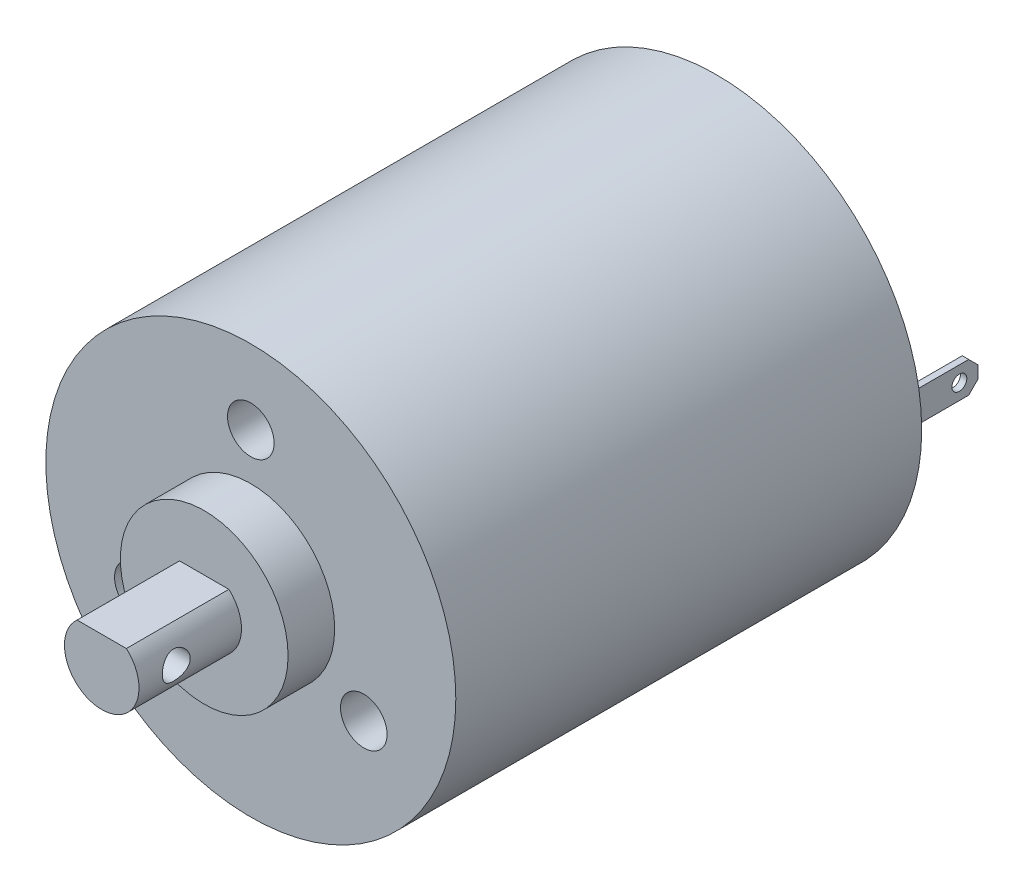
SolidWorks part; units mm, degrees
ref_plane "Plane1" through (0, 0, 0) normal (0, 0, 1) x (1, 0, 0)
ref_plane "Plane2" through (0, 0, 0) normal (0, 1, 0) x (1, 0, 0)
ref_plane "Plane3" through (0, 0, 0) normal (1, 0, 0) x (0, 0, -1)
sketch "Sketch1" plane through (0, 0, 0) normal (0, 0, 1) x (1, 0, 0)
  circle A0 centre (0, 0) radius 11
  dimension "D1" = 22
extrude "Base-Extrude" add sketch "Sketch1" against normal blind 25
sketch "Sketch2" plane through (0, 0, 0) normal (0, 0, 1) x (1, 0, 0)
  line L0 (-1.3229, 1.5) -> (1.3229, 1.5)
  arc A0 (-1.3229, 1.5) -> (1.3229, 1.5) centre (0, 0) ccw
  dimension "D1" = 4
  dimension "D2" = 1.5
extrude "Boss-Extrude1" add sketch "Sketch2" along normal blind 8
sketch "Sketch4" plane through (0, 0, 0) normal (0, 0, 1) x (1, 0, 0)
  circle A0 centre (0, 7) radius 1.25
  dimension "D1" = 2.5
  dimension "D2" = 7
extrude "Cut-Extrude2" cut sketch "Sketch4" against normal blind 4
pattern_circular "CirPattern1" count 3 over 360 about axis through (0, 0, 0) along (0, 0, 1) of "Cut-Extrude2"
sketch "Sketch5" plane through (0, 0, 0) normal (0, 0, 1) x (1, 0, 0)
  circle A0 centre (0, 0) radius 4.5
  dimension "D1" = 9
extrude "Boss-Extrude2" add sketch "Sketch5" along normal blind 2.5
sketch "Sketch6" plane through (0, 0, 0) normal (1, 0, 0) x (0, 0, -1)
  line L0 (25, 0) -> (0, 0) construction
  line L1 (-8, 1.5) -> (-8, -2) construction
  circle A0 centre (-6, 0) radius 0.75
  dimension "D1" = 1.5
  dimension "D2" = 2
extrude "Cut-Extrude3" cut sketch "Sketch6" against normal through all and the other way through all
sketch "Sketch7" plane through (0, 0, -25) normal (0, 0, -1) x (-1, 0, 0)
  line L0 (0, 0) -> (0, 4.1788) construction
  line L1 (-9.8202, 0.8326) -> (-9.4753, 0.8326)
  line L2 (-9.8202, 0.8326) -> (-9.8202, -0.8326)
  line L3 (-9.8202, -0.8326) -> (-9.4753, -0.8326)
  line L4 (-9.4753, 0.8326) -> (-9.4753, -0.8326)
  line L5 (0, 0) -> (-9.4753, 0) construction
  line L6 (9.4753, 0.8326) -> (9.4753, -0.8326)
  line L7 (9.8202, -0.8326) -> (9.4753, -0.8326)
  line L8 (9.8202, 0.8326) -> (9.8202, -0.8326)
  line L9 (9.8202, 0.8326) -> (9.4753, 0.8326)
extrude "Extrude1" add sketch "Sketch7" along normal blind 4.2
sketch "Sketch8" plane through (-9.8202, 0, 0) normal (-1, 0, 0) x (0, 0, 1)
  line L0 (-29.2, 0) -> (-28.2, 0) construction
  line L1 (-29.2, -0.8326) -> (-29.2, 0.8326) construction
  circle A0 centre (-28.2, 0) radius 0.4
  dimension "D1" = 0.8
  dimension "D2" = 1
extrude "Cut-Extrude4" cut sketch "Sketch8" against normal through all
chamfer "Chamfer1" distance 0.5 angle 45 4 edges at (9.6478, -0.8326, -29.2) (9.6478, 0.8326, -29.2) (-9.6478, -0.8326, -29.2) (-9.6478, 0.8326, -29.2)
